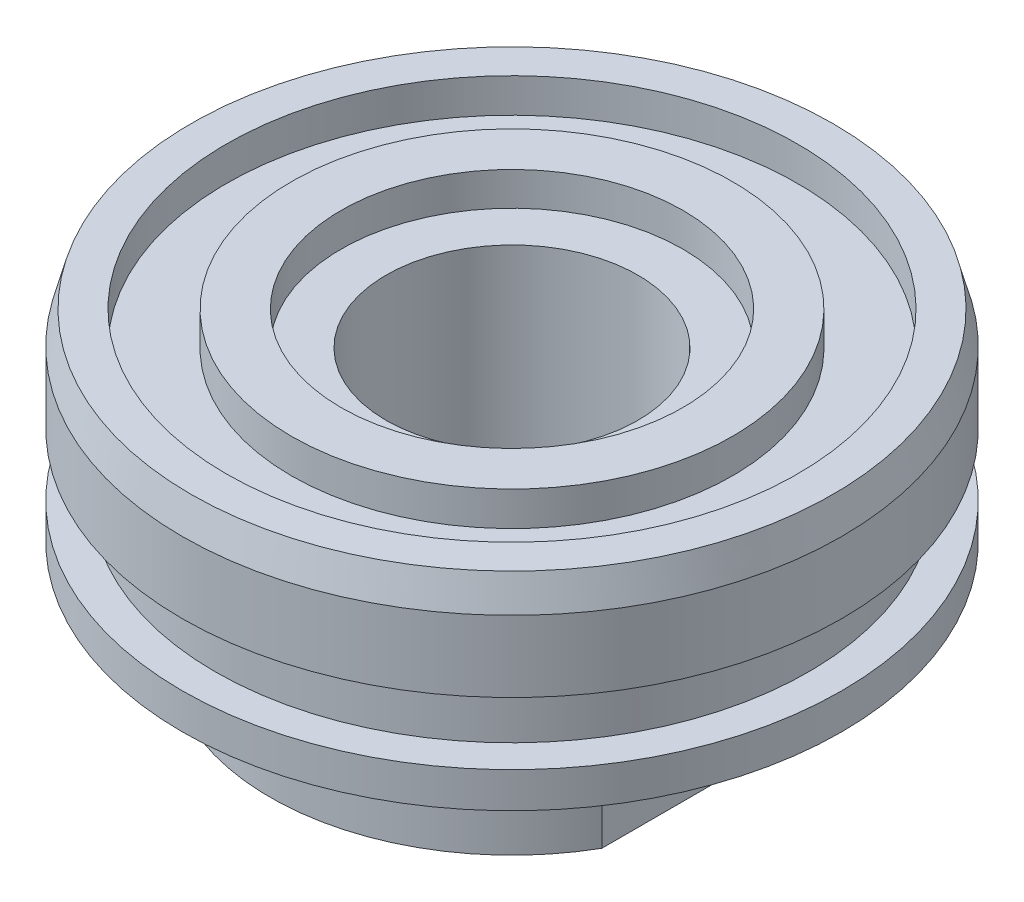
SolidWorks part; units mm, degrees
ref_plane "Front Plane" through (0, 0, 0) normal (0, 0, 1) x (1, 0, 0)
ref_plane "Top Plane" through (0, 0, 0) normal (0, 1, 0) x (1, 0, 0)
ref_plane "Right Plane" through (0, 0, 0) normal (1, 0, 0) x (0, 0, -1)
sketch "Sketch1" plane through (0, 0, 0) normal (0, 1, 0) x (1, 0, 0)
  circle A0 centre (0, 0) radius 12.4714
  circle A1 centre (0, 0) radius 4.7625
extrude "Extrude1" add sketch "Sketch1" along normal blind 11.43
sketch "Sketch2" plane through (0, 11.43, 0) normal (0, 1, 0) x (-1, 0, 0)
  circle A0 centre (0, 0) radius 10.8077
  circle A1 centre (0, 0) radius 8.3439
extrude "Cut-Extrude1" cut sketch "Sketch2" against normal blind 1.2954
sketch "Sketch3" plane through (0, 11.43, 0) normal (0, 1, 0) x (-1, 0, 0)
  circle A0 centre (0, 0) radius 6.4643
extrude "Cut-Extrude2" cut sketch "Sketch3" against normal blind 1.27
chamfer "Chamfer1" distance 1.2192 angle 15 1 edges at (0, 11.43, 12.4714)
sketch "Sketch4" plane through (0, 0, 0) normal (0, -1, 0) x (1, 0, 0)
  line L2 (7.9375, 0) -> (7.9375, -4.5397)
  line L3 (7.9375, 0) -> (7.9375, 4.5397)
  line L4 (-7.9375, 0) -> (-7.9375, -4.5397)
  line L5 (-7.9375, 0) -> (-7.9375, 4.5397)
  arc A0 (-7.9375, -4.5397) -> (7.9375, -4.5397) centre (0, 0) ccw
  arc A1 (7.9375, 4.5397) -> (-7.9375, 4.5397) centre (0, 0) ccw
extrude "Cut-Extrude3" cut sketch "Sketch4" against normal blind 3.81 flip side to cut
ref_plane "Plane1" through (0, 7.5184, 0) normal (0, 1, 0) x (-1, 0, 0)
sketch "Sketch5" plane through (0, 7.5184, 0) normal (0, 1, 0) x (-1, 0, 0)
  circle A0 centre (0, 0) radius 11.2268
extrude "Cut-Extrude4" cut sketch "Sketch5" against normal blind 2.3622 flip side to cut
